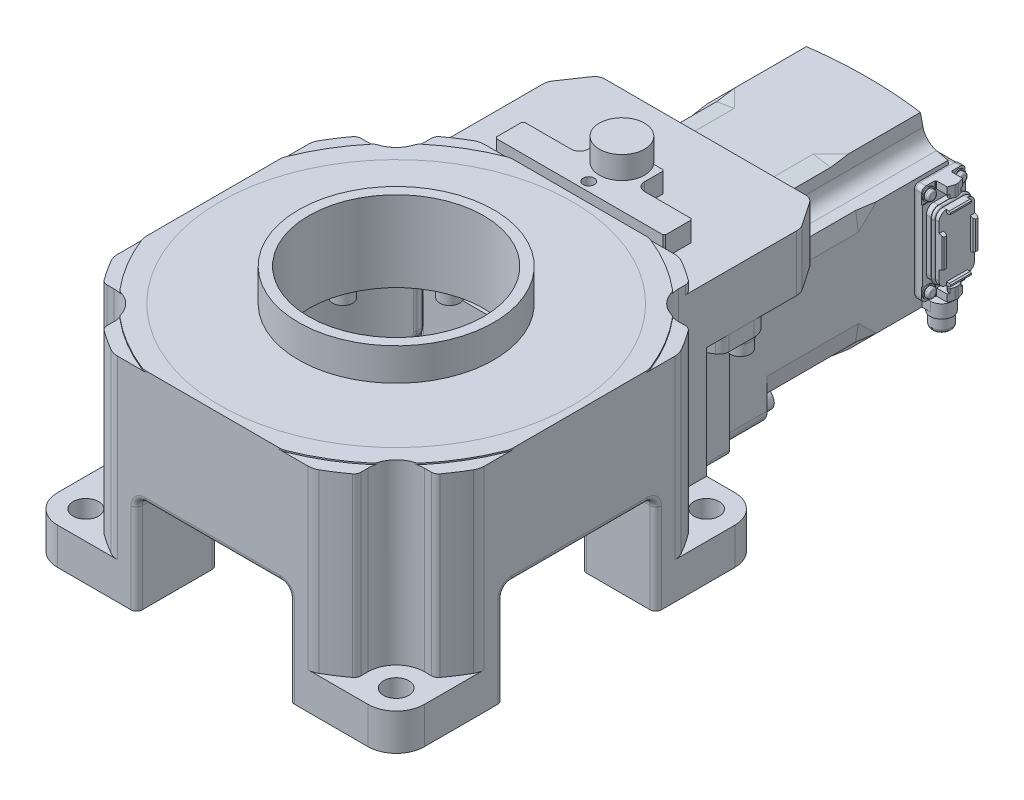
SolidWorks part; units mm, degrees
ref_plane "正面" through (0, 0, 0) normal (0, 0, 1) x (1, 0, 0)
ref_plane "平面" through (0, 0, 0) normal (0, 1, 0) x (1, 0, 0)
ref_plane "右側面" through (0, 0, 0) normal (1, 0, 0) x (0, 0, -1)
imported_body "ｲﾝﾎﾟｰﾄ1"
sketch "ｽｹｯﾁ2" plane through (0, 55, 0) normal (0, -1, 0) x (1, 0, 0)
  circle A0 centre (-13.3939, 32.3358) radius 3.5 construction
  circle A1 centre (-32.3358, 13.3939) radius 3.5 construction
  circle A2 centre (-32.3358, -13.3939) radius 3.5 construction
  circle A3 centre (-13.3939, -32.3358) radius 3.5 construction
  circle A4 centre (13.3939, -32.3358) radius 3.5 construction
  circle A5 centre (32.3358, -13.3939) radius 3.5 construction
  circle A6 centre (32.3358, 13.3939) radius 3.5 construction
  circle A7 centre (13.3939, 32.3358) radius 3.5 construction
  circle A8 centre (-13.3939, 32.3358) radius 3.5
  circle A9 centre (-32.3358, 13.3939) radius 3.5
  circle A10 centre (-32.3358, -13.3939) radius 3.5
  circle A11 centre (-13.3939, -32.3358) radius 3.5
  circle A12 centre (13.3939, -32.3358) radius 3.5
  circle A13 centre (32.3358, -13.3939) radius 3.5
  circle A14 centre (32.3358, 13.3939) radius 3.5
  circle A15 centre (13.3939, 32.3358) radius 3.5
  circle A16 centre (13.3939, 32.3358) radius 3.495
  circle A17 centre (32.3358, 13.3939) radius 3.495
  circle A18 centre (32.3358, -13.3939) radius 3.495
  circle A19 centre (13.3939, -32.3358) radius 3.495
  circle A20 centre (-13.3939, -32.3358) radius 3.495
  circle A21 centre (-32.3358, -13.3939) radius 3.495
  circle A22 centre (-32.3358, 13.3939) radius 3.495
  circle A23 centre (-13.3939, 32.3358) radius 3.495
  point P41 (0, 0)
  dimension "D1" = 6.99
  dimension "D2" = 8
extrude "ｶｯﾄ - 押し出し1" cut sketch "ｽｹｯﾁ2" against normal up to surface (4 mm away)
